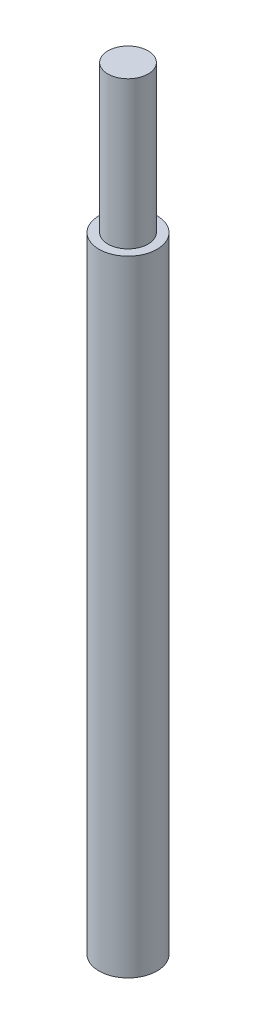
SolidWorks part; units mm, degrees
ref_plane "Front Plane" through (0, 0, 0) normal (0, 0, 1) x (1, 0, 0)
ref_plane "Top Plane" through (0, 0, 0) normal (0, 1, 0) x (1, 0, 0)
ref_plane "Right Plane" through (0, 0, 0) normal (1, 0, 0) x (0, 0, -1)
sketch "Sketch1" plane through (0, 0, 0) normal (0, 0, 1) x (1, 0, 0)
  line L0 (1.651, -22.7655) -> (1.651, 12.7945)
  line L1 (0, -22.7655) -> (1.651, -22.7655)
  line L2 (0, -22.7655) -> (0, 21.1765)
  line L3 (0, 21.1765) -> (1.143, 21.1765)
  line L4 (1.143, 21.1765) -> (1.143, 12.7945)
  line L5 (1.143, 12.7945) -> (1.651, 12.7945)
  dimension "D1" = 1.651
  dimension "D2" = 1.143
  dimension "D3" = 43.942
  dimension "D4" = 35.56
revolve "Revolve1" add sketch "Sketch1" angle 360 about L2
